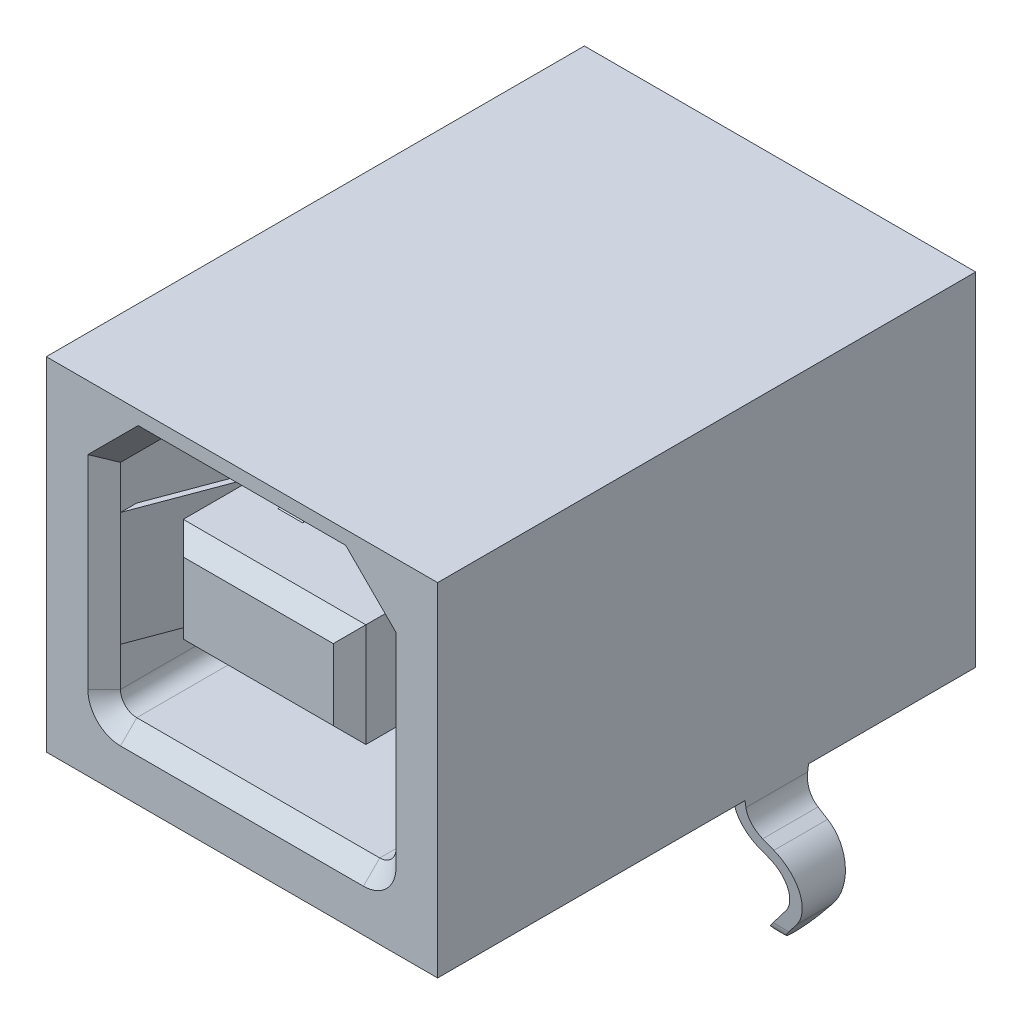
SolidWorks part; units mm, degrees
ref_plane "Front" through (0, 0, 0) normal (0, 0, 1) x (1, 0, 0)
ref_plane "Top" through (0, 0, 0) normal (0, 1, 0) x (1, 0, 0)
ref_plane "Right" through (0, 0, 0) normal (1, 0, 0) x (0, 0, -1)
sketch "Sketch1" plane through (0, 0, 0) normal (0, 0, 1) x (1, 0, 0)
  line L0 (-6, 5.25) -> (6, -5.25) construction
  line L1 (-6, 5.25) -> (6, 5.25)
  line L2 (-6, 5.25) -> (-6, -5.25)
  line L3 (-6, -5.25) -> (6, -5.25)
  line L4 (6, 5.25) -> (6, -5.25)
  dimension "D1" = 12
  dimension "D2" = 10.5
extrude "Base" add sketch "Sketch1" along normal mid plane 16.5
sketch "Sketch2" plane through (0, 0, 8.25) normal (0, 0, 1) x (1, 0, 0)
  line L0 (-2.975, 4.33) -> (-4.225, 3.08)
  line L1 (3.725, -3.45) -> (-3.725, -3.45)
  line L2 (4.225, -2.95) -> (4.225, 3.08)
  line L3 (2.975, 4.33) -> (-2.975, 4.33)
  line L4 (-4.225, -2.95) -> (-4.225, 3.08)
  line L5 (4.225, 3.08) -> (2.975, 4.33)
  line L6 (4.225, 4.33) -> (-4.225, -3.45) construction
  line L7 (6, 5.25) -> (-6, 5.25) construction
  line L9 (0, 0.44) -> (13.9883, 0.44) construction
  arc A0 (-3.725, -3.45) -> (-4.225, -2.95) centre (-3.725, -2.95) cw
  arc A1 (3.725, -3.45) -> (4.225, -2.95) centre (3.725, -2.95) ccw
  point P1 (4.225, 4.33)
  point P2 (-4.225, 4.33)
  point P12 (-4.225, -3.45)
  dimension "D1" = 0.5
  dimension "D2" = 4.81
  dimension "D3" = 8.45
  dimension "D5" = 7.78
  dimension "D6" = 1.25
  dimension "D7" = 1.25
extrude "Contact Opening" cut sketch "Sketch2" against normal blind 9
chamfer "Contact Opening Lead-in" distance 0.5 angle 45 8 edges at (-3.6, 3.705, 8.25) (0, 4.33, 8.25) (3.6, 3.705, 8.25) (4.225, 0.065, 8.25) (4.0786, -3.3036, 8.25) (0, -3.45, 8.25) (-4.0786, -3.3036, 8.25) (-4.225, 0.065, 8.25)
sketch "Sketch3" plane through (0, 0, -0.75) normal (0, 0, 1) x (1, 0, 0)
  line L0 (-2.8, 2.03) -> (2.8, -1.15) construction
  line L1 (-2.8, 2.03) -> (2.8, 2.03)
  line L2 (-2.8, 2.03) -> (-2.8, -1.15)
  line L3 (-2.8, -1.15) -> (2.8, -1.15)
  line L4 (2.8, 2.03) -> (2.8, -1.15)
  dimension "D1" = 5.6
  dimension "D2" = 3.18
extrude "Contact Area" add sketch "Sketch3" along normal blind 8.5
chamfer "Contact Area Lead-in" distance 0.5 angle 45 4 edges at (0, 2.03, 7.75) (2.8, 0.44, 7.75) (0, -1.15, 7.75) (-2.8, 0.44, 7.75)
ref_plane "Ground Leg Plane" through (0, 0, -2.15) normal (0, 0, 1) x (1, 0, 0)
sketch "Sketch4" plane through (0, 0, -2.15) normal (0, 0, 1) x (1, 0, 0)
  line L0 (0, 0) -> (0, -12.5407) construction
  line L1 (6.02, -5.058) -> (5.72, -5.1007)
  line L2 (6.4225, -5.35) -> (8.1, -5.35)
  line L3 (8.1, -5.35) -> (8.1, -5.65)
  line L5 (-6.1857, -5.65) -> (-8.1, -5.65)
  line L6 (-8.1, -5.35) -> (-8.1, -5.65)
  line L7 (-6.4225, -5.35) -> (-8.1, -5.35)
  line L8 (-6.02, -5.058) -> (-5.72, -5.1007)
  line L9 (6.1857, -5.65) -> (8.1, -5.65)
  arc A0 (6.02, -5.058) -> (6.4225, -5.35) centre (6.3271, -5.058) ccw
  arc A1 (-5.72, -5.1007) -> (-6.1857, -5.65) centre (-6.3271, -5.058) cw
  arc A2 (-6.02, -5.058) -> (-6.4225, -5.35) centre (-6.3271, -5.058) cw
  arc A5 (5.72, -5.1007) -> (6.1857, -5.65) centre (6.3271, -5.058) ccw
  dimension "D2" = 8.1
  dimension "D3" = 0.3
  dimension "D1" = 10.6
sketch "Sketch7" plane through (0, 0, 0) normal (0, 1, 0) x (1, 0, 0)
  line L0 (-4.225, -7.75) -> (-3.2152, -5.0513)
  line L1 (-3.3072, -2.7298) -> (-3.695, -1.9)
  line L2 (0, 0) -> (0, -8.8202) construction
  line L3 (-3.4657, -2.8039) -> (-3.8535, -1.9741)
  line L4 (-4.3889, -7.6887) -> (-3.3791, -4.99)
  line L5 (-3.695, -1.9) -> (-3.8535, -1.9741)
  line L6 (-4.225, -7.75) -> (-4.3889, -7.6887)
  line L7 (4.225, -7.75) -> (4.3889, -7.6887)
  line L8 (3.695, -1.9) -> (3.8535, -1.9741)
  line L9 (4.3889, -7.6887) -> (3.3791, -4.99)
  line L10 (3.4657, -2.8039) -> (3.8535, -1.9741)
  line L11 (3.3072, -2.7298) -> (3.695, -1.9)
  line L12 (4.225, -7.75) -> (3.2152, -5.0513)
  arc A0 (-3.2152, -5.0513) -> (-3.3072, -2.7298) centre (-6.025, -4) ccw
  arc A1 (-3.3791, -4.99) -> (-3.4657, -2.8039) centre (-6.025, -4) ccw
  arc A2 (3.3791, -4.99) -> (3.4657, -2.8039) centre (6.025, -4) cw
  arc A3 (3.2152, -5.0513) -> (3.3072, -2.7298) centre (6.025, -4) cw
  dimension "D2" = 3
  dimension "D5" = 3.75
  dimension "D1" = 5.85
  dimension "D3" = 1.8
  dimension "D4" = 0.53
  dimension "D6" = 0.175
extrude "Holding Tines" add sketch "Sketch7" along normal mid plane 3.5
ref_plane "Tail Plane" through (0, 0, -7.4) normal (0, 0, -1) x (-1, 0, 0)
ref_plane "Contact Plane" through (-1.25, 0, 0) normal (1, 0, 0) x (0, 0, -1)
ref_plane "SM TAILS PLANE" through (0.75, 0, 0) normal (1, 0, 0) x (0, 0, -1)
sketch "Sketch8" plane through (-1.25, 0, 0) normal (1, 0, 0) x (0, 0, -1)
  line L0 (0.75, 2.03) -> (-2.6953, 2.6783)
  line L1 (-4.4185, 2.4931) -> (-5.75, 1.93)
  line L2 (-7.25, 2.03) -> (0.75, 2.03) construction
  line L3 (0.75, 3.08) -> (0.75, -2.95) construction
  line L4 (-4.3503, 2.3319) -> (-5.6818, 1.7688)
  line L5 (0.7176, 1.858) -> (-2.7276, 2.5063)
  line L6 (0.7176, 1.858) -> (0.75, 2.03)
  line L7 (-5.6818, 1.7688) -> (-5.75, 1.93)
  line L8 (0.75, 2.03) -> (0.75, -1.15) construction
  line L9 (0.75, 0.44) -> (-6.7483, 0.44) construction
  line L10 (-5.6818, -0.8888) -> (-5.75, -1.05)
  line L11 (0.7176, -0.978) -> (0.75, -1.15)
  line L12 (0.7176, -0.978) -> (-2.7276, -1.6263)
  line L13 (-4.3503, -1.4519) -> (-5.6818, -0.8888)
  line L14 (-4.4185, -1.6131) -> (-5.75, -1.05)
  line L15 (0.75, -1.15) -> (-2.6953, -1.7983)
  arc A0 (-2.6953, 2.6783) -> (-4.4185, 2.4931) centre (-3.25, -0.27) ccw
  arc A1 (-2.7276, 2.5063) -> (-4.3503, 2.3319) centre (-3.25, -0.27) ccw
  arc A2 (-2.7276, -1.6263) -> (-4.3503, -1.4519) centre (-3.25, 1.15) cw
  arc A3 (-2.6953, -1.7983) -> (-4.4185, -1.6131) centre (-3.25, 1.15) cw
  dimension "D2" = 3
  dimension "D3" = 2.3
  dimension "D4" = 4
  dimension "D1" = 6.5
  dimension "D5" = 0.1
  dimension "D6" = 0.175
extrude "Contact" add sketch "Sketch8" along normal mid plane 0.75
pattern_linear "Contact Pattern" count 2 spacing 2.5 along (1, 0, 0) of "Contact"
sketch "Sketch12" plane through (0, -5.25, 0) normal (0, -1, 0) x (1, 0, 0)
  line L0 (0, 0) -> (0, 5.4435) construction
  line L1 (3.1821, 8.25) -> (4.725, 8.25) construction
  circle A0 centre (2.75, -0.75) radius 0.575
  circle A1 centre (-2.75, -0.75) radius 0.575
  point P5 (3.9536, 8.25)
  dimension "D1" = 1.15
  dimension "D2" = 2.75
  dimension "D3" = 9
sketch "Sketch13" plane through (0, 0, -2.15) normal (0, 0, 1) x (1, 0, 0)
  line L0 (6, -5.25) -> (6, -5.45)
  line L1 (6.4164, -6.1217) -> (6.736, -6.2805)
  line L2 (7.1575, -8.1791) -> (6.5272, -8.97)
  line L3 (6.8604, -7.9422) -> (6.23, -8.7332)
  line L4 (6.2473, -6.462) -> (6.567, -6.6208)
  line L5 (5.62, -5.25) -> (5.62, -5.45)
  line L6 (6.5272, -8.97) -> (6.23, -8.7332)
  line L7 (5.62, -5.25) -> (6, -5.25)
  line L8 (0, 0) -> (0, -9.739) construction
  line L9 (-6, -5.25) -> (6, -5.25) construction
  line L10 (6, -5.25) -> (6, 5.25) construction
  line L11 (-5.62, -5.25) -> (-6, -5.25)
  line L12 (-6.5272, -8.97) -> (-6.23, -8.7332)
  line L13 (-5.62, -5.25) -> (-5.62, -5.45)
  line L14 (-6.2473, -6.462) -> (-6.567, -6.6208)
  line L15 (-6.8604, -7.9422) -> (-6.23, -8.7332)
  line L16 (-7.1575, -8.1791) -> (-6.5272, -8.97)
  line L17 (-6.4164, -6.1217) -> (-6.736, -6.2805)
  line L18 (-6, -5.25) -> (-6, -5.45)
  arc A0 (6, -5.45) -> (6.4164, -6.1217) centre (6.75, -5.45) ccw
  arc A1 (6.736, -6.2805) -> (7.1575, -8.1791) centre (6.18, -7.4) cw
  arc A2 (6.567, -6.6208) -> (6.8604, -7.9422) centre (6.18, -7.4) cw
  arc A3 (5.62, -5.45) -> (6.2473, -6.462) centre (6.75, -5.45) ccw
  arc A4 (-5.62, -5.45) -> (-6.2473, -6.462) centre (-6.75, -5.45) cw
  arc A5 (-6.567, -6.6208) -> (-6.8604, -7.9422) centre (-6.18, -7.4) ccw
  arc A6 (-6.736, -6.2805) -> (-7.1575, -8.1791) centre (-6.18, -7.4) ccw
  arc A7 (-6, -5.45) -> (-6.4164, -6.1217) centre (-6.75, -5.45) cw
  dimension "D2" = 1.95
  dimension "D3" = 1.57
  dimension "D5" = 0.75
  dimension "D6" = 0.87
  dimension "D8" = 0.3472
  dimension "D1" = 0.2
  dimension "D4" = 0.38
  dimension "D7" = 0.18
extrude "TH Ground Legs" add sketch "Sketch13" along normal mid plane 1.95
sketch "Sketch14" plane through (0, 0, 0) normal (1, 0, 0) x (0, 0, -1)
  line L0 (3.125, -5.25) -> (3.125, -9)
  line L1 (2.6448, -8.5422) -> (3.125, -5.25)
  line L2 (3.125, -5.25) -> (8.25, -5.25) construction
  line L3 (1.6552, -8.5422) -> (1.175, -5.25)
  line L4 (1.175, -5.25) -> (1.175, -9)
  line L5 (3.125, -9) -> (1.175, -9)
  line L6 (2.15, -8.97) -> (2.15, -9.8721) construction
  line L7 (1.175, -8.97) -> (3.125, -8.97) construction
  arc A0 (1.6552, -8.5422) -> (2.6448, -8.5422) centre (2.15, -8.47) ccw
  point P1 (2.15, -9)
  dimension "D2" = 0.5
  dimension "D4" = 3.75
  dimension "D1" = 3.75
  dimension "D3" = 1.95
extrude "TH Ground Leg Shape" cut sketch "Sketch14" against normal through all and the other way through all
sketch "Sketch15" plane through (0, 0, -7.4) normal (0, 0, -1) x (-1, 0, 0)
  line L0 (-1.58, -5.25) -> (-0.92, -5.25)
  line L1 (-1.58, -5.25) -> (-1.58, -8.1)
  line L2 (-1.4588, -8.4) -> (-1.0412, -8.4)
  line L3 (-0.92, -5.25) -> (-0.92, -8.1)
  line L4 (-1.58, -8.1) -> (-1.4588, -8.4)
  line L5 (-0.92, -8.1) -> (-1.0412, -8.4)
  line L7 (0.92, -8.1) -> (1.0412, -8.4)
  line L8 (1.58, -8.1) -> (1.4588, -8.4)
  line L9 (0.92, -5.25) -> (0.92, -8.1)
  line L10 (1.4588, -8.4) -> (1.0412, -8.4)
  line L11 (1.58, -5.25) -> (1.58, -8.1)
  line L12 (1.58, -5.25) -> (0.92, -5.25)
  line L14 (0, 0) -> (0, -9.474) construction
  line L15 (6, -5.25) -> (-6, -5.25) construction
  dimension "D1" = 0.3
  dimension "D2" = 0.66
  dimension "D3" = 0.92
  dimension "D4" = 0.1212
  dimension "D5" = 3.15
  dimension "D6" = 0.1212
extrude "TH Tails" add sketch "Sketch15" along normal mid plane 0.25
pattern_linear "TH Tails Pattern" count 2 spacing 2 along (0, 0, 1) of "TH Tails"
